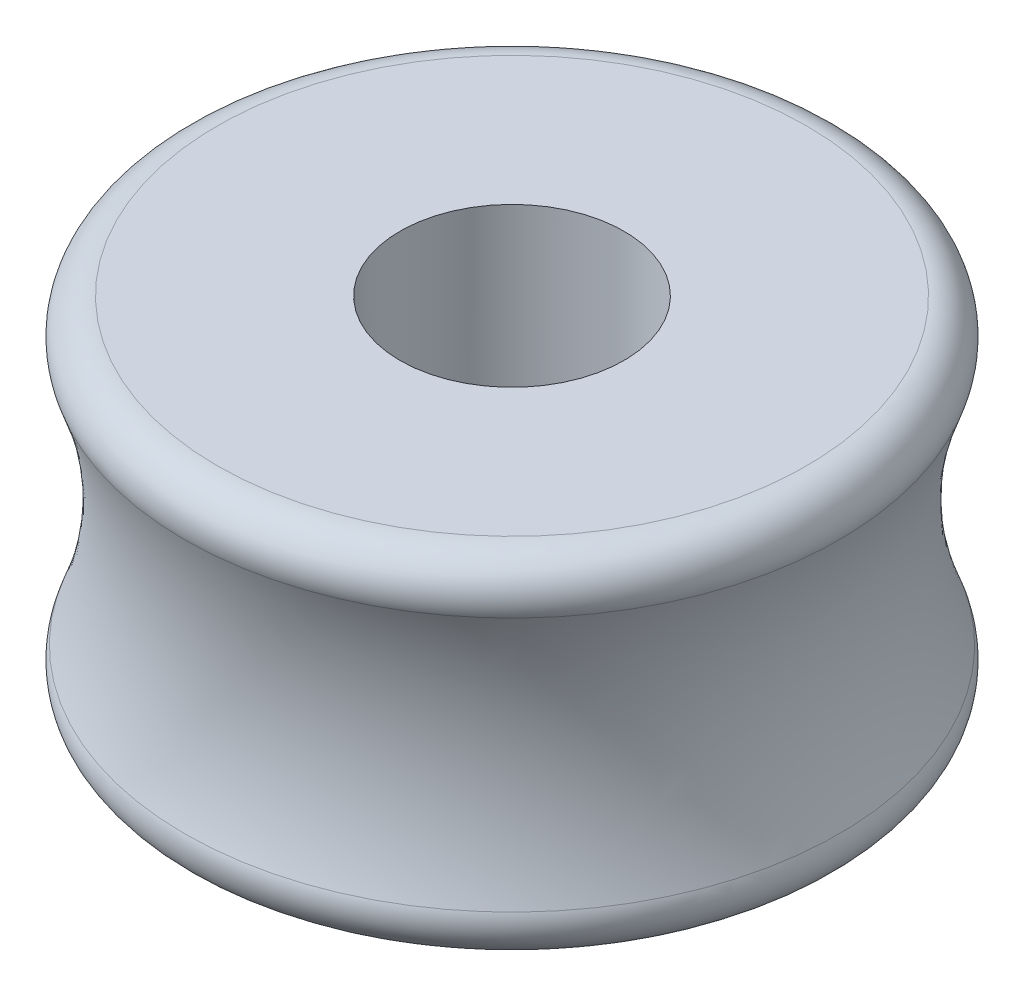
SolidWorks part; units mm, degrees
ref_plane "Front Plane" through (0, 0, 0) normal (0, 0, 1) x (1, 0, 0)
ref_plane "Top Plane" through (0, 0, 0) normal (0, 1, 0) x (1, 0, 0)
ref_plane "Right Plane" through (0, 0, 0) normal (1, 0, 0) x (0, 0, -1)
sketch "Sketch1" plane through (0, 0, 0) normal (0, 0, 1) x (1, 0, 0)
  line L0 (-4.2067, 0) -> (-1.6, 0)
  line L1 (-1.6, 0) -> (-1.6, -5)
  line L2 (-1.6, -5) -> (-4.2067, -5)
  line L3 (0, 0) -> (0, -5) construction
  arc A0 (-4.6724, -0.6818) -> (-4.6724, -4.3182) centre (-9.3301, -2.5) cw
  arc A1 (-4.6724, -4.3182) -> (-4.2067, -5) centre (-4.2067, -4.5) ccw
  arc A2 (-4.6724, -0.6818) -> (-4.2067, 0) centre (-4.2067, -0.5) cw
  point P10 (-5, -5)
  point P13 (-5, 0)
  dimension "D4" = 5
  dimension "D5" = 0.5
  dimension "D1" = 1.6
  dimension "D2" = 5
  dimension "D3" = 5
revolve "Revolve1" add sketch "Sketch1" angle 360 about L3
chamfer "Chamfer1" distance 0.16 angle 45 1 edges at (0, -5, 1.6)
